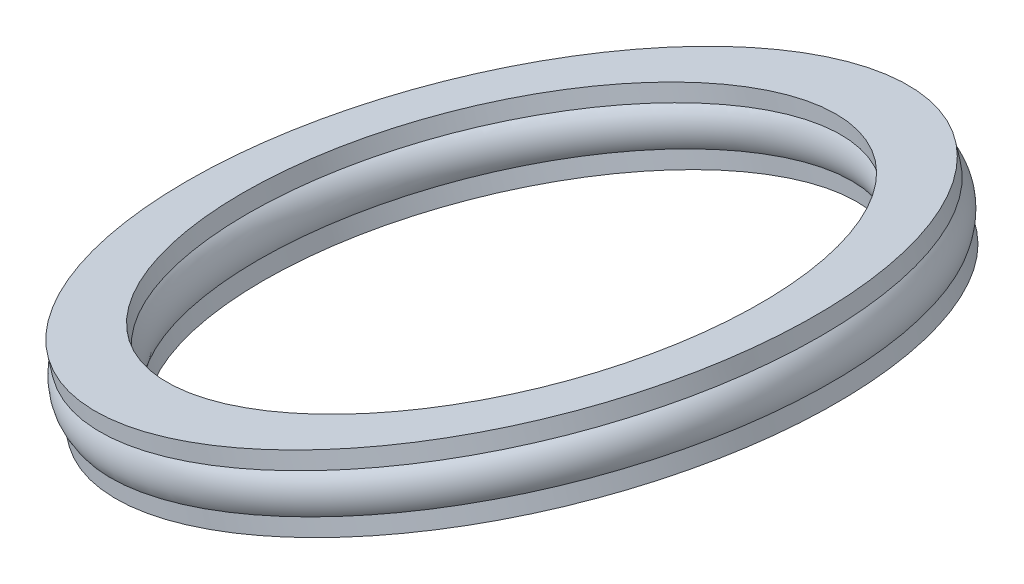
SolidWorks part; units mm, degrees
ref_plane "Alzado" through (0, 0, 0) normal (0, 0, 1) x (1, 0, 0)
ref_plane "Planta" through (0, 0, 0) normal (0, 1, 0) x (1, 0, 0)
ref_plane "Vista lateral" through (0, 0, 0) normal (1, 0, 0) x (0, 0, -1)
sketch "Sk_Jaula" plane through (0, 0, 0) normal (0, 0, 1) x (1, 0, 0)
  line L0 (425.3708, 395.2701) -> (428.6135, 396.2926)
  line L1 (428.6135, 396.2926) -> (429.8163, 392.4777)
  line L2 (429.8163, 392.4777) -> (426.5737, 391.4553)
  line L3 (426.5737, 391.4553) -> (425.3708, 395.2701)
  line L4 (408.7986, 395.2874) -> (419.3236, 361.9074) construction
revolve "Jaula" add sketch "Sk_Jaula" angle 360 about L4
sketch "Sk_Bolas" plane through (0, 0, 0) normal (0, 0, 1) x (1, 0, 0)
  line L0 (407.8964, 398.1486) -> (413.9107, 379.0743) construction
  circle A0 centre (427.5936, 393.8739) radius 2
  dimension "DIAM1" = 4
revolve "Bolas" add sketch "Sk_Bolas" angle 360 about L0
